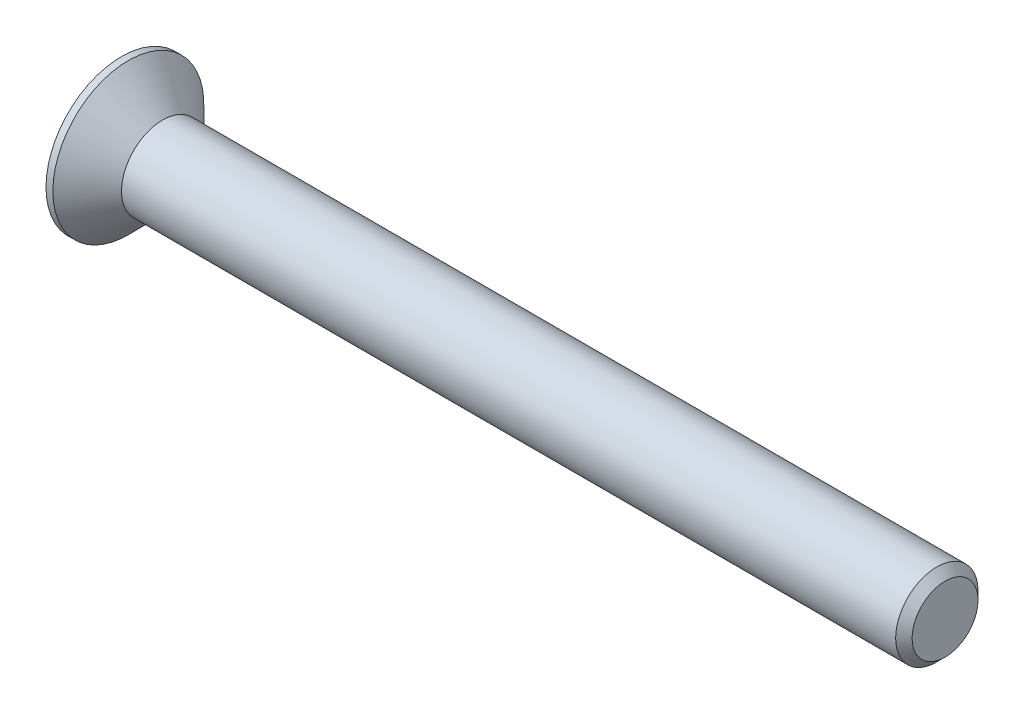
SolidWorks part; units mm, degrees
ref_plane "Front Plane" through (0, 0, 0) normal (0, 0, 1) x (1, 0, 0)
ref_plane "Top Plane" through (0, 0, 0) normal (0, 1, 0) x (1, 0, 0)
ref_plane "Right Plane" through (0, 0, 0) normal (1, 0, 0) x (0, 0, -1)
sketch "Sketch1" plane through (0, 0, 0) normal (0, 0, 1) x (1, 0, 0)
  line L1 (-3, 5.5) -> (-3, 0)
  line L2 (-3, 0) -> (57, 0)
  line L3 (57, 0) -> (57, 3)
  line L4 (57, 3) -> (0, 3)
  line L5 (-3, 5.5) -> (-2.5, 5.5)
  line L6 (-2.5, 5.5) -> (0, 3)
  dimension "D1" = 3
  dimension "D2" = 45
  dimension "D3" = 3
  dimension "D4" = 60
  dimension "D5" = 5.5
revolve "Revolve1" add sketch "Sketch1" angle 360 about L2
chamfer "Chamfer1" distance 0.6 angle 45 1 edges at (57, 0, 3)
sketch "Sketch2" plane through (-3, 0, 0) normal (-1, 0, 0) x (0, 0, 1)
  line L0 (-0.825, 3.3) -> (0.825, 3.3)
  line L1 (0.825, 3.3) -> (0.825, 0.825)
  line L2 (0.825, 0.825) -> (3.3, 0.825)
  line L3 (3.3, 0.825) -> (3.3, -0.825)
  line L4 (3.3, -0.825) -> (0.825, -0.825)
  line L5 (0.825, -0.825) -> (0.825, -3.3)
  line L6 (0.825, -3.3) -> (-0.825, -3.3)
  line L7 (-0.825, -3.3) -> (-0.825, -0.825)
  line L8 (-0.825, -0.825) -> (-3.3, -0.825)
  line L9 (-3.3, -0.825) -> (-3.3, 0.825)
  line L10 (-3.3, 0.825) -> (-0.825, 0.825)
  line L11 (-0.825, 0.825) -> (-0.825, 3.3)
  point P2 (0, 3.3)
  point P14 (0, -3.3)
  point P15 (3.3, 0)
  point P16 (-3.3, 0)
  dimension "D1" = 6.6
  dimension "D2" = 1.65
extrude "Cut-Extrude1" cut sketch "Sketch2" against normal blind 2.5
